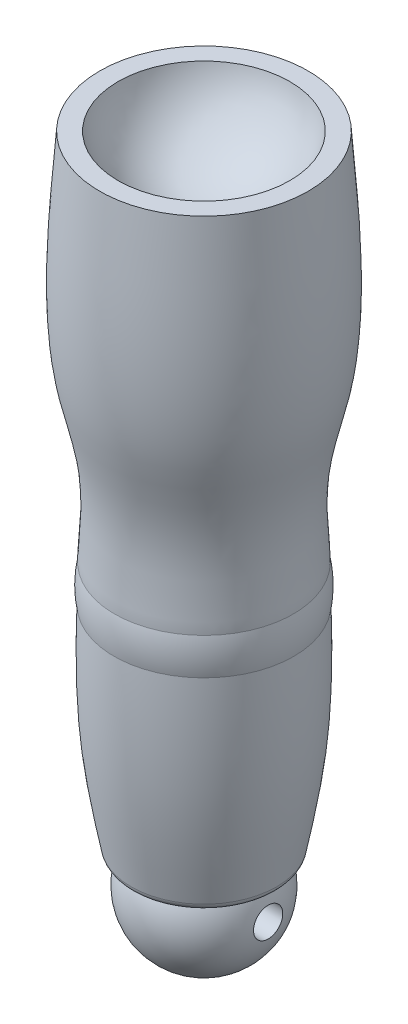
SolidWorks part; units mm, degrees
ref_plane "Plan de face" through (0, 0, 0) normal (0, 0, 1) x (1, 0, 0)
ref_plane "Plan de dessus" through (0, 0, 0) normal (0, 1, 0) x (1, 0, 0)
ref_plane "Plan de droite" through (0, 0, 0) normal (1, 0, 0) x (0, 0, -1)
sketch "Esquisse1" plane through (0, 0, 0) normal (0, 0, 1) x (1, 0, 0)
  line L0 (0, 76.1787) -> (0, -60.4913) construction
  line L1 (0, 0) -> (-39, 0)
  line L2 (0, 0) -> (0, 342)
  line L3 (0, 342) -> (-57, 342)
  line L4 (-48.8513, 137.7014) -> (-49.1385, 117.8037) construction
  arc A0 (-48.8513, 137.7014) -> (-49.1385, 117.8037) centre (0, 127.0454) ccw
  spline S0 degree 3 poles (-39, 0) (-42.4937, 17.8173) (-49.5677, 53.8939) (-49.8128, 98.5414) (-49.1385, 117.8037) knots 0 0 0 0 0.1638 0.331664 0.331664 0.331664 0.331664
  spline S1 degree 3 poles (-48.8513, 137.7014) (-48.9422, 142.6513) (-44.6851, 184.2854) (-65.6354, 233.1627) (-60.3712, 299.5107) (-57, 342) knots 0.416311 0.416311 0.416311 0.416311 0.459605 0.653931 1 1 1 1
  dimension "D4" = 50
  dimension "D1" = 342
  dimension "D2" = 114
  dimension "D3" = 78
  dimension "D5" = 49
revolve "Révolution1" add sketch "Esquisse1" angle 360 about L2
sketch "Esquisse2" plane through (0, 0, 0) normal (0, 0, 1) x (1, 0, 0)
  line L0 (0, 256.5131) -> (0, 532.3095) construction
  line L2 (0, 304) -> (0, 400)
  line L3 (57, 342) -> (-57, 342) construction
  arc A0 (0, 304) -> (0, 400) centre (0, 352) ccw
  dimension "D1" = 96
  dimension "D2" = 10
revolve "Enlèvement de matière-Révolution1" cut sketch "Esquisse2" angle 360 about L0
sketch "Esquisse3" plane through (0, 0, 0) normal (0, 0, 1) x (1, 0, 0)
  line L0 (0, 80.789) -> (0, -74.8085) construction
  line L1 (-63.1625, -15) -> (123.1716, -15) construction
  line L2 (35.0999, -7) -> (-35.0999, -7)
  arc A0 (35.0999, -7) -> (-35.0999, -7) centre (0, -15) ccw
  dimension "D1" = 72
  dimension "D2" = 15
  dimension "D3" = 16
revolve "Révolution3" add sketch "Esquisse3" angle 360 about L1
fillet "Congé1" radius 5 1 edges at (39, 0, 0)
